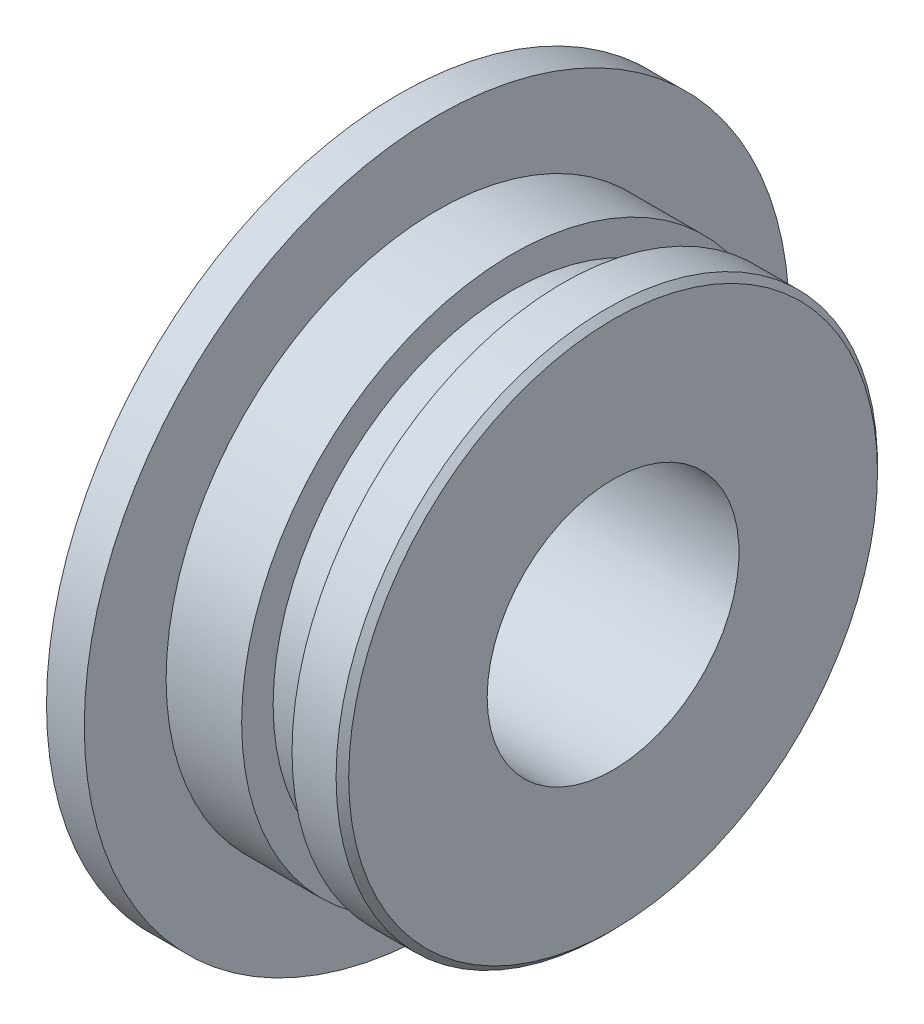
SolidWorks part; units mm, degrees
ref_plane "Front" through (0, 0, 0) normal (0, 0, 1) x (1, 0, 0)
ref_plane "Top" through (0, 0, 0) normal (0, 1, 0) x (1, 0, 0)
ref_plane "Right" through (0, 0, 0) normal (1, 0, 0) x (0, 0, -1)
sketch "Sketch1" plane through (0, 0, 0) normal (0, 0, 1) x (1, 0, 0)
  line L0 (0, 5) -> (0, 8.4)
  line L1 (0, 8.4) -> (2.4, 8.4)
  line L2 (2.4, 8.4) -> (2.4, 14)
  line L3 (2.4, 14) -> (3.9, 14)
  line L4 (3.9, 14) -> (3.9, 10.75)
  line L5 (3.9, 10.75) -> (6.9, 10.75)
  line L6 (6.9, 10.75) -> (6.9, 9.5)
  line L7 (6.9, 9.5) -> (8.9, 9.5)
  line L8 (8.9, 9.5) -> (8.9, 10.75)
  line L9 (8.9, 10.75) -> (10.9, 10.75)
  line L10 (10.9, 10.75) -> (10.9, 5)
  line L11 (0, 0) -> (20.6482, 0) construction
  line L12 (0, 5) -> (10.9, 5)
  dimension "D1" = 2.4
  dimension "D2" = 1.5
  dimension "D3" = 3
  dimension "D4" = 2
  dimension "D5" = 2
  dimension "D6" = 5
  dimension "D7" = 8.4
  dimension "D8" = 14
revolve "Revolve1" add sketch "Sketch1" angle 360 about L11
chamfer "Chamfer1" distance 0.25 distance2 0.25 1 edges at (10.9, 0, 10.75)
